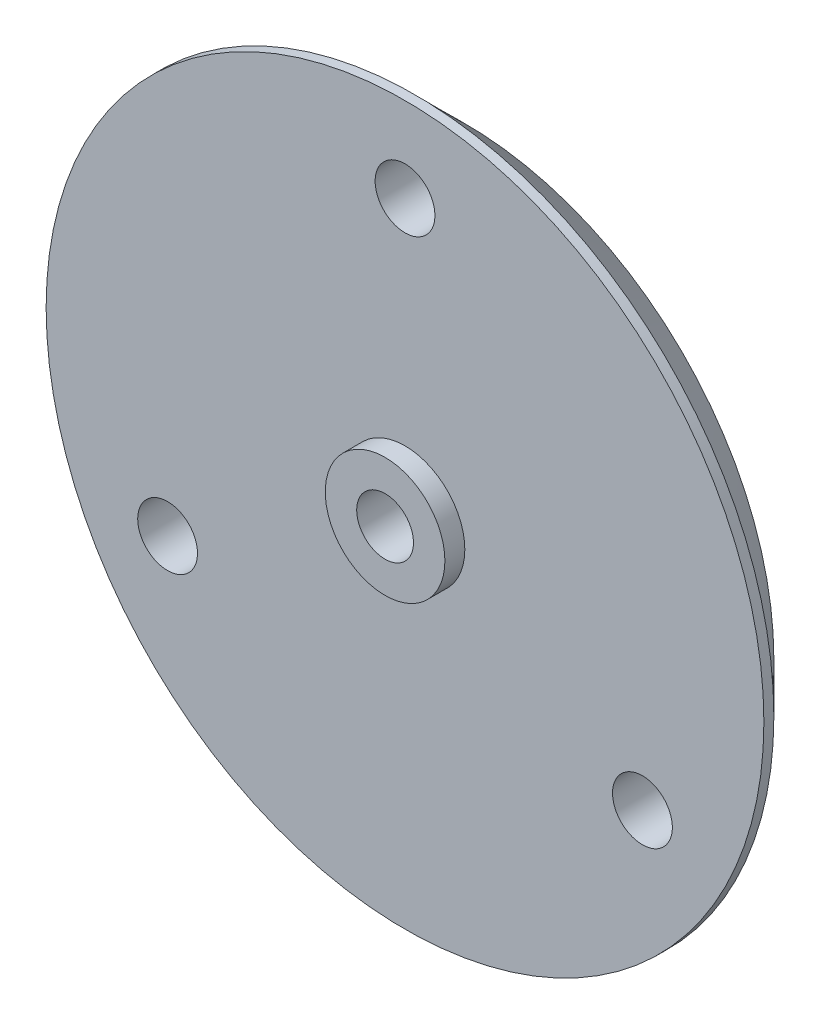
SolidWorks part; units mm, degrees
ref_plane "Plan de face" through (0, 0, 0) normal (0, 0, 1) x (1, 0, 0)
ref_plane "Plan de dessus" through (0, 0, 0) normal (0, 1, 0) x (1, 0, 0)
ref_plane "Plan de droite" through (0, 0, 0) normal (1, 0, 0) x (0, 0, -1)
sketch "Esquisse1" plane through (0, 0, 0) normal (0, 0, 1) x (1, 0, 0)
  circle A1 centre (0, 0) radius 18
extrude "Extrusion1" add sketch "Esquisse1" along normal blind 3
chamfer "Chanfrein1" distance 2.5 angle 45 1 edges at (18, 0, 0)
sketch "Esquisse2" plane through (0, 0, 0) normal (0, 0, -1) x (-1, 0, 0)
  circle A0 centre (0, 0) radius 4.45 construction
  circle A1 centre (0, 0) radius 6.45 construction
  circle A2 centre (0, 0) radius 8.45 construction
  circle A3 centre (0, 0) radius 11.45 construction
  circle A4 centre (0, 0) radius 4.95
  circle A5 centre (0, 0) radius 3.95
  circle A6 centre (0, 0) radius 6.95
  circle A7 centre (0, 0) radius 8.95
  circle A8 centre (0, 0) radius 11.95
  circle A9 centre (0, 0) radius 5.95
  circle A10 centre (0, 0) radius 7.95
  circle A11 centre (0, 0) radius 10.95
  dimension "D1" = 0.5
  dimension "D2" = 0.5
  dimension "D3" = 0.5
  dimension "D4" = 0.5
extrude "Enlèv. mat.-Extru.1" cut sketch "Esquisse2" against normal blind 1.6
sketch "Esquisse3" plane through (0, 0, 0) normal (0, 0, -1) x (-1, 0, 0)
  circle A0 centre (0, 0) radius 13.75 construction
  circle A1 centre (0, 13.75) radius 1.5
extrude "Enlèv. mat.-Extru.2" cut sketch "Esquisse3" against normal through all
pattern_circular "Répétition circulaire1" count 3 every 120 about axis through (0, 0, 0) along (0, 0, 1) of "Enlèv. mat.-Extru.2"
sketch "Esquisse5" plane through (0, 0, 3) normal (0, 0, 1) x (1, 0, 0)
  circle A0 centre (0, 0) radius 3
extrude "Extrusion2" add sketch "Esquisse5" along normal blind 1
sketch "Esquisse6" plane through (0, 0, 0) normal (0, 0, -1) x (-1, 0, 0)
  circle A0 centre (0, 0) radius 1.425
extrude "Enlèv. mat.-Extru.3" cut sketch "Esquisse6" against normal through all
